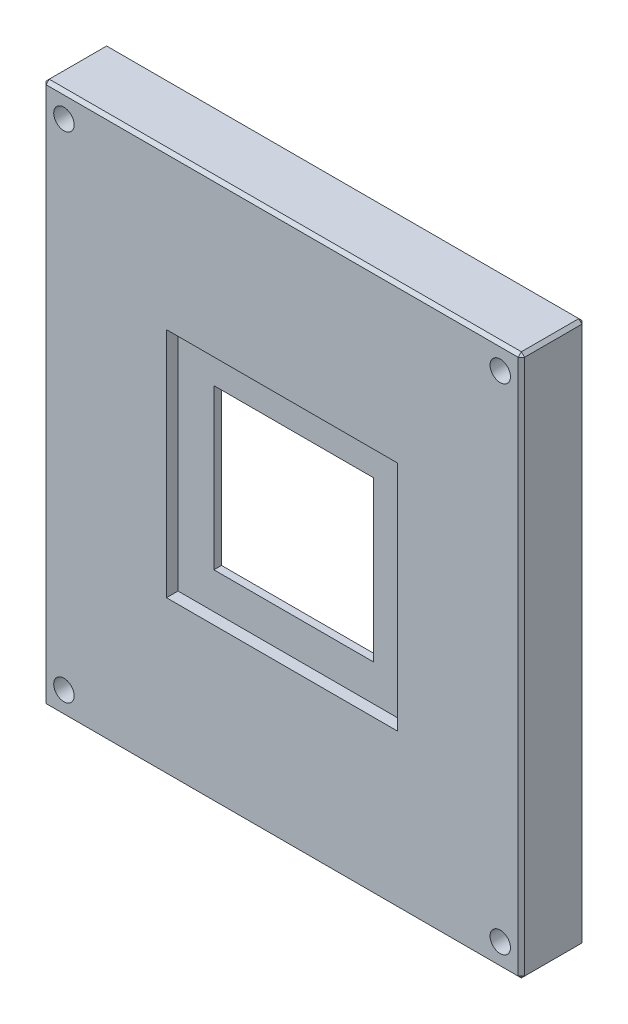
SolidWorks part; units mm, degrees
ref_plane "Front Plane" through (0, 0, 0) normal (0, 0, 1) x (1, 0, 0)
ref_plane "Top Plane" through (0, 0, 0) normal (0, 1, 0) x (1, 0, 0)
ref_plane "Right Plane" through (0, 0, 0) normal (1, 0, 0) x (0, 0, -1)
sketch "Sketch1" plane through (0, 0, 0) normal (0, 0, 1) x (1, 0, 0)
  line L1 (-12.5, -12.5) -> (12.5, -12.5)
  line L2 (-12.5, -12.5) -> (-12.5, 12.5)
  line L3 (-12.5, 12.5) -> (12.5, 12.5)
  line L4 (12.5, -12.5) -> (12.5, 12.5)
  line L5 (-12.5, -12.5) -> (12.5, 12.5) construction
  line L6 (-12.5, 12.5) -> (12.5, -12.5) construction
  line L7 (-37.5, -42.5) -> (37.5, -42.5)
  line L8 (-37.5, -42.5) -> (-37.5, 42.5)
  line L9 (-37.5, 42.5) -> (37.5, 42.5)
  line L10 (37.5, -42.5) -> (37.5, 42.5)
  line L11 (-37.5, -42.5) -> (37.5, 42.5) construction
  line L12 (-37.5, 42.5) -> (37.5, -42.5) construction
  point P0 (0, 0)
  point P6 (0, 0)
  dimension "clear_aperture_y" = 25
  dimension "clear_aperture_x" = 25
  dimension "main_body_x" = 75
  dimension "main_body_y" = 85
extrude "main_body" add sketch "Sketch1" along normal blind 10
sketch "Sketch2" plane through (0, 0, 10) normal (0, 0, 1) x (1, 0, 0)
  line L1 (-18.12, -18.195) -> (18.12, -18.195)
  line L2 (-18.12, -18.195) -> (-18.12, 18.195)
  line L3 (-18.12, 18.195) -> (18.12, 18.195)
  line L4 (18.12, -18.195) -> (18.12, 18.195)
  line L5 (-18.12, -18.195) -> (18.12, 18.195) construction
  line L6 (-18.12, 18.195) -> (18.12, -18.195) construction
  point P0 (0, 0)
  dimension "LC_shutter_x" = 36.24
  dimension "LC_shutter_y" = 36.39
extrude "LC_shutter_recess" cut sketch "Sketch2" against normal blind 1.81
chamfer "Chamfer2" distance 7 angle 45 4 edges at (0, -12.5, 0) (12.5, 0, 0) (0, 12.5, 0) (-12.5, 0, 0)
sketch "Sketch3" plane through (0, -42.5, 0) normal (0, -1, 0) x (1, 0, 0)
  line L0 (-37.5, 0) -> (37.5, 0) construction
  line L1 (37.5, 0) -> (-37.5, 0) construction
  line L2 (37.5, 0) -> (37.5, 10) construction
  line L3 (37.5, 10) -> (-37.5, 10) construction
  line L4 (-37.5, 0) -> (-37.5, 10) construction
  line L5 (37.5, 0) -> (-37.5, 10) construction
  line L6 (37.5, 10) -> (-37.5, 0) construction
  line L7 (37.5, 10) -> (37.5, 0) construction
  circle A0 centre (0, 5) radius 2.8
  point P0 (0, 5)
  dimension "D1" = 5.6
extrude "M4_threaded_insert_hole" cut sketch "Sketch3" against normal blind 10
sketch "Sketch4" plane through (0, 0, 10) normal (0, 0, 1) x (1, 0, 0)
  line L1 (37.5, -42.5) -> (-37.5, -42.5) construction
  line L2 (37.5, -42.5) -> (37.5, 42.5) construction
  line L3 (37.5, 42.5) -> (-37.5, 42.5) construction
  line L4 (-37.5, -42.5) -> (-37.5, 42.5) construction
  line L5 (37.5, -42.5) -> (-37.5, 42.5) construction
  line L6 (37.5, 42.5) -> (-37.5, -42.5) construction
  circle A0 centre (-34.1919, 38.7508) radius 1.6
  point P0 (0, 0)
  dimension "D1" = 3.2
  dimension "M2_hole_distance_from_corner" = 5
extrude "M2_threaded_insert_hole" cut sketch "Sketch4" against normal through all
mirror "Mirror1" about plane through (0, 0, 0) normal (0, 1, 0) of "M2_threaded_insert_hole"
mirror "Mirror2" about plane through (0, 0, 0) normal (1, 0, 0) of "Mirror1", "M2_threaded_insert_hole"
chamfer "Chamfer3" distance 0.5 angle 45 12 edges at (0, -42.5, 0) (0, -42.5, 10) (-37.5, -42.5, 5) (-37.5, 0, 10) (-37.5, 0, 0) (0, 42.5, 10) (-37.5, 42.5, 5) (0, 42.5, 0) (37.5, 42.5, 5) (37.5, 0, 0) (37.5, -42.5, 5) (37.5, 0, 10)
